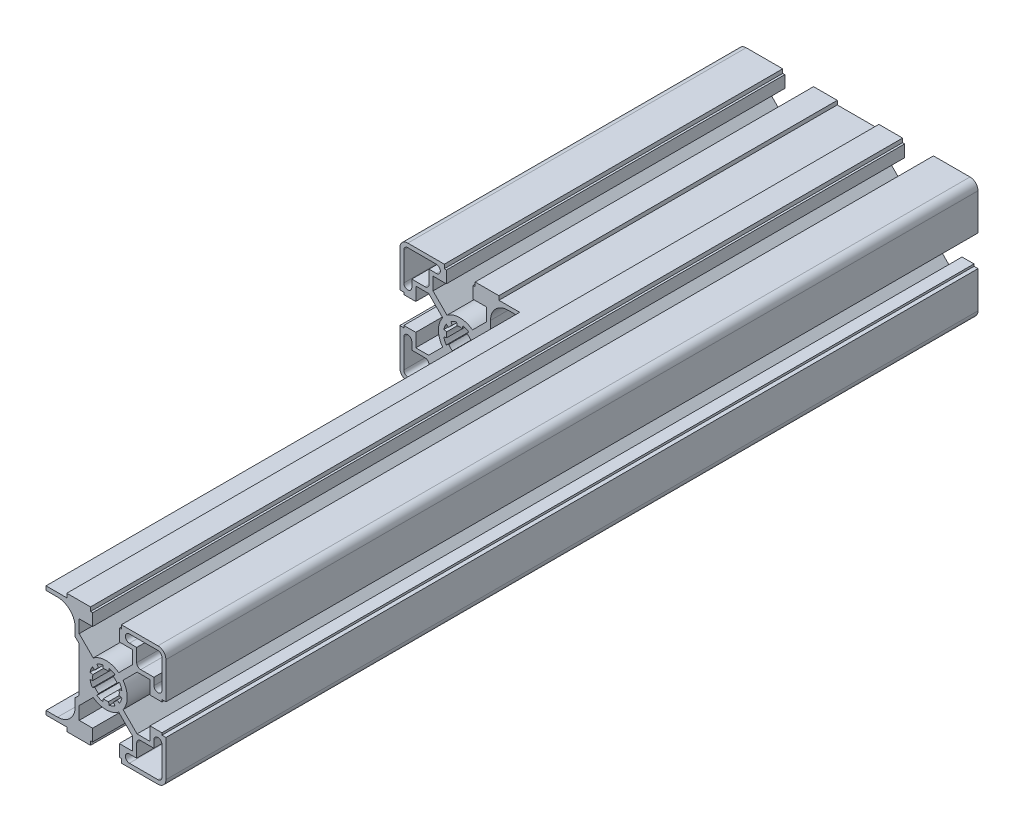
SolidWorks part; units mm, degrees
ref_plane "Front Plane" through (0, 0, 0) normal (0, 0, 1) x (1, 0, 0)
ref_plane "Top Plane" through (0, 0, 0) normal (0, 1, 0) x (1, 0, 0)
ref_plane "Right Plane" through (0, 0, 0) normal (1, 0, 0) x (0, 0, -1)
sketch "Sketch1" plane through (0, 0, 0) normal (0, 0, 1) x (1, 0, 0)
  line L0 (-27.5082, 0) -> (-17.5006, 0) construction
  line L1 (17.5006, 0) -> (27.5082, 0) construction
  line L2 (-42.0116, 22.5044) -> (-28.2956, 22.5044)
  line L3 (-28.2956, 22.5044) -> (-28.2956, 21.0058)
  line L4 (-28.2956, 21.0058) -> (-27.5082, 21.0058)
  line L5 (22.5044, -5.0038) -> (22.5044, 5.0038) construction
  line L6 (-27.5082, 21.0058) -> (-27.5082, 16.51)
  line L7 (-27.5082, 16.51) -> (-32.5501, 16.51)
  line L8 (-32.5501, 16.51) -> (-32.5501, 11.6801)
  line L9 (-32.5501, 11.6801) -> (-27.2854, 6.4154)
  line L11 (-34.1845, 10.0457) -> (-28.9198, 4.781)
  line L12 (-39.0144, 10.0457) -> (-34.1845, 10.0457)
  line L13 (-39.0144, 5.0038) -> (-39.0144, 10.0457)
  line L14 (-43.5102, 5.0038) -> (-39.0144, 5.0038)
  line L15 (-43.5102, 5.7912) -> (-43.5102, 5.0038)
  line L16 (-45.0088, 5.7912) -> (-43.5102, 5.7912)
  line L17 (-45.0088, 19.5072) -> (-45.0088, 5.7912)
  line L18 (-40.513, 11.5443) -> (-35.5473, 11.5443)
  line L19 (-40.513, 11.5443) -> (-40.513, 8.7884)
  line L20 (-34.0487, 18.0086) -> (-34.0487, 13.0429)
  line L21 (-43.5102, 19.5072) -> (-43.5102, 8.7884)
  line L23 (-34.0487, 18.0086) -> (-31.2928, 18.0086)
  line L24 (-42.0116, 21.0058) -> (-31.2928, 21.0058)
  line L25 (-21.3151, 5.9789) -> (-21.5282, 4.9077)
  line L26 (-23.6937, 5.9789) -> (-23.4806, 4.9077)
  line L27 (-17.4358, 3.3868) -> (-18.3439, 2.78)
  line L28 (-19.1176, 5.0686) -> (-19.7244, 4.1605)
  line L29 (-16.5255, -1.1893) -> (-17.5967, -0.9762)
  line L30 (-16.5255, 1.1893) -> (-17.5967, 0.9762)
  line L31 (-19.1176, -5.0686) -> (-19.7244, -4.1605)
  line L32 (-17.4358, -3.3868) -> (-18.3439, -2.78)
  line L33 (-23.6937, -5.9789) -> (-23.4806, -4.9077)
  line L34 (-21.3151, -5.9789) -> (-21.5282, -4.9077)
  line L35 (-27.573, -3.3868) -> (-26.6649, -2.78)
  line L36 (-25.8912, -5.0686) -> (-25.2844, -4.1605)
  line L37 (-28.4833, 1.1893) -> (-27.4121, 0.9762)
  line L38 (-28.4833, -1.1893) -> (-27.4121, -0.9762)
  line L39 (-25.8912, 5.0686) -> (-25.2844, 4.1605)
  line L40 (-27.573, 3.3868) -> (-26.6649, 2.78)
  line L41 (-7.8105, 22.5044) -> (-7.8105, 21.0058)
  line L42 (-7.8105, 21.0058) -> (7.8105, 21.0058)
  line L43 (-7.8105, 22.5044) -> (-16.7132, 22.5044)
  line L44 (-16.7132, 22.5044) -> (-16.7132, 21.0058)
  line L45 (-16.7132, 21.0058) -> (-17.5006, 21.0058)
  line L46 (-17.5006, 21.0058) -> (-17.5006, 16.51)
  line L47 (-17.5006, 16.51) -> (-12.4587, 16.51)
  line L48 (-12.4587, 16.51) -> (-12.4587, 11.6801)
  line L49 (-12.4587, 11.6801) -> (-17.7234, 6.4154)
  line L50 (-10.9601, 9.9099) -> (-12.4587, 8.4113)
  line L51 (7.8105, 21.0058) -> (7.8105, 22.5044)
  line L53 (-7.8105, -22.5044) -> (-16.7132, -22.5044)
  line L54 (7.8105, -22.5044) -> (16.7132, -22.5044)
  line L55 (7.8105, -21.0058) -> (7.8105, -22.5044)
  line L56 (-7.8105, -21.0058) -> (7.8105, -21.0058)
  line L57 (-7.8105, -22.5044) -> (-7.8105, -21.0058)
  line L58 (-40.513, -11.5443) -> (-35.5473, -11.5443)
  line L59 (4.3561, 19.5072) -> (-4.3561, 19.5072)
  line L60 (-10.9601, 12.9032) -> (-10.9601, 9.9099)
  line L61 (-12.4587, -8.4113) -> (-10.9601, -9.9099)
  line L62 (-12.4587, 8.4113) -> (-12.4587, -8.4113)
  line L63 (-10.9601, -12.9032) -> (-10.9601, -9.9099)
  line L64 (4.3561, -19.5072) -> (-4.3561, -19.5072)
  line L65 (10.9601, 12.9032) -> (10.9601, 9.9099)
  line L66 (10.9601, -12.9032) -> (10.9601, -9.9099)
  line L67 (12.4587, 8.4113) -> (12.4587, -8.4113)
  line L68 (10.9601, -9.9099) -> (12.4587, -8.4113)
  line L69 (10.9601, 9.9099) -> (12.4587, 8.4113)
  line L70 (-12.4587, -11.6801) -> (-17.7234, -6.4154)
  line L71 (-12.4587, -16.51) -> (-12.4587, -11.6801)
  line L72 (-17.5006, -16.51) -> (-12.4587, -16.51)
  line L73 (-17.5006, -21.0058) -> (-17.5006, -16.51)
  line L74 (-16.7132, -21.0058) -> (-17.5006, -21.0058)
  line L75 (-16.7132, -22.5044) -> (-16.7132, -21.0058)
  line L76 (-34.0487, -18.0086) -> (-31.2928, -18.0086)
  line L77 (-42.0116, -21.0058) -> (-31.2928, -21.0058)
  line L78 (-42.0116, -22.5044) -> (-28.2956, -22.5044)
  line L79 (-28.2956, -22.5044) -> (-28.2956, -21.0058)
  line L80 (-28.2956, -21.0058) -> (-27.5082, -21.0058)
  line L81 (-27.5082, -21.0058) -> (-27.5082, -16.51)
  line L82 (-27.5082, -16.51) -> (-32.5501, -16.51)
  line L83 (-32.5501, -16.51) -> (-32.5501, -11.6801)
  line L84 (-32.5501, -11.6801) -> (-27.2854, -6.4154)
  line L85 (-34.1845, -10.0457) -> (-28.9198, -4.781)
  line L86 (-43.5102, -19.5072) -> (-43.5102, -8.7884)
  line L87 (-34.0487, -18.0086) -> (-34.0487, -13.0429)
  line L88 (-40.513, -11.5443) -> (-40.513, -8.7884)
  line L89 (-45.0088, -19.5072) -> (-45.0088, -5.7912)
  line L90 (-45.0088, -5.7912) -> (-43.5102, -5.7912)
  line L91 (-43.5102, -5.7912) -> (-43.5102, -5.0038)
  line L92 (-43.5102, -5.0038) -> (-39.0144, -5.0038)
  line L93 (-39.0144, -5.0038) -> (-39.0144, -10.0457)
  line L94 (-39.0144, -10.0457) -> (-34.1845, -10.0457)
  line L96 (42.0116, 21.0058) -> (31.2928, 21.0058)
  line L97 (42.0116, 22.5044) -> (28.2956, 22.5044)
  line L98 (34.0487, 18.0086) -> (31.2928, 18.0086)
  line L99 (27.5082, 21.0058) -> (27.5082, 16.51)
  line L100 (28.2956, 21.0058) -> (27.5082, 21.0058)
  line L101 (28.2956, 22.5044) -> (28.2956, 21.0058)
  line L102 (17.5006, 21.0058) -> (17.5006, 16.51)
  line L103 (16.7132, 21.0058) -> (17.5006, 21.0058)
  line L104 (16.7132, 22.5044) -> (16.7132, 21.0058)
  line L105 (7.8105, 22.5044) -> (16.7132, 22.5044)
  line L106 (39.0144, -10.0457) -> (34.1845, -10.0457)
  line L107 (39.0144, -5.0038) -> (39.0144, -10.0457)
  line L108 (43.5102, -5.0038) -> (39.0144, -5.0038)
  line L109 (43.5102, -5.7912) -> (43.5102, -5.0038)
  line L110 (45.0088, -5.7912) -> (43.5102, -5.7912)
  line L111 (45.0088, -19.5072) -> (45.0088, -5.7912)
  line L112 (40.513, -11.5443) -> (35.5473, -11.5443)
  line L113 (40.513, -11.5443) -> (40.513, -8.7884)
  line L114 (34.0487, -18.0086) -> (34.0487, -13.0429)
  line L115 (43.5102, -19.5072) -> (43.5102, -8.7884)
  line L116 (34.1845, -10.0457) -> (28.9198, -4.781)
  line L117 (32.5501, -11.6801) -> (27.2854, -6.4154)
  line L118 (32.5501, -16.51) -> (32.5501, -11.6801)
  line L119 (27.5082, -16.51) -> (32.5501, -16.51)
  line L120 (27.5082, -21.0058) -> (27.5082, -16.51)
  line L121 (28.2956, -21.0058) -> (27.5082, -21.0058)
  line L122 (28.2956, -22.5044) -> (28.2956, -21.0058)
  line L123 (42.0116, -22.5044) -> (28.2956, -22.5044)
  line L124 (42.0116, -21.0058) -> (31.2928, -21.0058)
  line L125 (34.0487, -18.0086) -> (31.2928, -18.0086)
  line L126 (16.7132, -22.5044) -> (16.7132, -21.0058)
  line L127 (16.7132, -21.0058) -> (17.5006, -21.0058)
  line L128 (17.5006, -21.0058) -> (17.5006, -16.51)
  line L129 (17.5006, -16.51) -> (12.4587, -16.51)
  line L130 (12.4587, -16.51) -> (12.4587, -11.6801)
  line L131 (12.4587, -11.6801) -> (17.7234, -6.4154)
  line L132 (12.4587, 11.6801) -> (17.7234, 6.4154)
  line L133 (12.4587, 16.51) -> (12.4587, 11.6801)
  line L134 (27.573, 3.3868) -> (26.6649, 2.78)
  line L135 (25.8912, 5.0686) -> (25.2844, 4.1605)
  line L136 (28.4833, -1.1893) -> (27.4121, -0.9762)
  line L137 (28.4833, 1.1893) -> (27.4121, 0.9762)
  line L138 (25.8912, -5.0686) -> (25.2844, -4.1605)
  line L139 (27.573, -3.3868) -> (26.6649, -2.78)
  line L140 (21.3151, -5.9789) -> (21.5282, -4.9077)
  line L141 (23.6937, -5.9789) -> (23.4806, -4.9077)
  line L142 (17.4358, -3.3868) -> (18.3439, -2.78)
  line L143 (19.1176, -5.0686) -> (19.7244, -4.1605)
  line L144 (16.5255, 1.1893) -> (17.5967, 0.9762)
  line L145 (16.5255, -1.1893) -> (17.5967, -0.9762)
  line L146 (19.1176, 5.0686) -> (19.7244, 4.1605)
  line L147 (17.4358, 3.3868) -> (18.3439, 2.78)
  line L148 (23.6937, 5.9789) -> (23.4806, 4.9077)
  line L149 (21.3151, 5.9789) -> (21.5282, 4.9077)
  line L150 (43.5102, 19.5072) -> (43.5102, 8.7884)
  line L151 (34.0487, 18.0086) -> (34.0487, 13.0429)
  line L152 (40.513, 11.5443) -> (40.513, 8.7884)
  line L153 (40.513, 11.5443) -> (35.5473, 11.5443)
  line L154 (45.0088, 19.5072) -> (45.0088, 5.7912)
  line L155 (45.0088, 5.7912) -> (43.5102, 5.7912)
  line L156 (43.5102, 5.7912) -> (43.5102, 5.0038)
  line L157 (43.5102, 5.0038) -> (39.0144, 5.0038)
  line L158 (39.0144, 5.0038) -> (39.0144, 10.0457)
  line L159 (39.0144, 10.0457) -> (34.1845, 10.0457)
  line L160 (34.1845, 10.0457) -> (28.9198, 4.781)
  line L161 (32.5501, 11.6801) -> (27.2854, 6.4154)
  line L162 (32.5501, 16.51) -> (32.5501, 11.6801)
  line L163 (12.4587, 16.51) -> (17.5006, 16.51)
  line L164 (27.5082, 16.51) -> (32.5501, 16.51)
  arc A0 (-45.0088, 19.5072) -> (-42.0116, 22.5044) centre (-42.0116, 19.5072) cw
  arc A1 (-43.5102, 8.7884) -> (-40.513, 8.7884) centre (-42.0116, 8.7884) ccw
  arc A2 (-43.5102, 19.5072) -> (-42.0116, 21.0058) centre (-42.0116, 19.5072) cw
  arc A3 (-31.2928, 21.0058) -> (-31.2928, 18.0086) centre (-31.2928, 19.5072) cw
  arc A4 (-34.0487, 13.0429) -> (-35.5473, 11.5443) centre (-35.5473, 13.0429) cw
  arc A6 (-21.5282, 4.9077) -> (-23.4806, 4.9077) centre (-22.5044, 0) ccw
  arc A7 (-27.573, 3.3868) -> (-28.4833, 1.1893) centre (-22.5044, 0) ccw
  arc A8 (-18.3439, 2.78) -> (-19.7244, 4.1605) centre (-22.5044, 0) ccw
  arc A9 (-17.5967, -0.9762) -> (-17.5967, 0.9762) centre (-22.5044, 0) ccw
  arc A10 (-19.7244, -4.1605) -> (-18.3439, -2.78) centre (-22.5044, 0) ccw
  arc A11 (-23.4806, -4.9077) -> (-21.5282, -4.9077) centre (-22.5044, 0) ccw
  arc A12 (-26.6649, -2.78) -> (-25.2844, -4.1605) centre (-22.5044, 0) ccw
  arc A13 (-27.4121, 0.9762) -> (-27.4121, -0.9762) centre (-22.5044, 0) ccw
  arc A14 (-25.2844, 4.1605) -> (-26.6649, 2.78) centre (-22.5044, 0) ccw
  arc A15 (-28.4833, -1.1893) -> (-27.573, -3.3868) centre (-22.5044, 0) ccw
  arc A16 (-25.8912, -5.0686) -> (-23.6937, -5.9789) centre (-22.5044, 0) ccw
  arc A17 (-21.3151, -5.9789) -> (-19.1176, -5.0686) centre (-22.5044, 0) ccw
  arc A18 (-17.4358, -3.3868) -> (-16.5255, -1.1893) centre (-22.5044, 0) ccw
  arc A19 (-16.5255, 1.1893) -> (-17.4358, 3.3868) centre (-22.5044, 0) ccw
  arc A20 (-19.1176, 5.0686) -> (-21.3151, 5.9789) centre (-22.5044, 0) ccw
  arc A21 (-23.6937, 5.9789) -> (-25.8912, 5.0686) centre (-22.5044, 0) ccw
  arc A22 (-34.0487, -13.0429) -> (-35.5473, -11.5443) centre (-35.5473, -13.0429) ccw
  arc A23 (-4.3561, 19.5072) -> (-10.9601, 12.9032) centre (-4.3561, 12.9032) ccw
  arc A24 (-4.3561, -19.5072) -> (-10.9601, -12.9032) centre (-4.3561, -12.9032) cw
  arc A25 (4.3561, 19.5072) -> (10.9601, 12.9032) centre (4.3561, 12.9032) cw
  arc A26 (4.3561, -19.5072) -> (10.9601, -12.9032) centre (4.3561, -12.9032) ccw
  arc A27 (-31.2928, -21.0058) -> (-31.2928, -18.0086) centre (-31.2928, -19.5072) ccw
  arc A28 (-43.5102, -19.5072) -> (-42.0116, -21.0058) centre (-42.0116, -19.5072) ccw
  arc A29 (-45.0088, -19.5072) -> (-42.0116, -22.5044) centre (-42.0116, -19.5072) ccw
  arc A30 (-43.5102, -8.7884) -> (-40.513, -8.7884) centre (-42.0116, -8.7884) cw
  arc A31 (-17.7234, 6.4154) -> (-27.2854, 6.4154) centre (-22.5044, 0) ccw
  arc A32 (-27.2854, -6.4154) -> (-17.7234, -6.4154) centre (-22.5044, 0) ccw
  arc A33 (-28.9198, 4.781) -> (-28.9198, -4.781) centre (-22.5044, 0) ccw
  arc A34 (45.0088, 19.5072) -> (42.0116, 22.5044) centre (42.0116, 19.5072) ccw
  arc A35 (43.5102, 19.5072) -> (42.0116, 21.0058) centre (42.0116, 19.5072) ccw
  arc A36 (31.2928, 21.0058) -> (31.2928, 18.0086) centre (31.2928, 19.5072) ccw
  arc A37 (28.9198, 4.781) -> (28.9198, -4.781) centre (22.5044, 0) cw
  arc A38 (27.2854, -6.4154) -> (17.7234, -6.4154) centre (22.5044, 0) cw
  arc A39 (17.7234, 6.4154) -> (27.2854, 6.4154) centre (22.5044, 0) cw
  arc A40 (43.5102, -8.7884) -> (40.513, -8.7884) centre (42.0116, -8.7884) ccw
  arc A41 (34.0487, -13.0429) -> (35.5473, -11.5443) centre (35.5473, -13.0429) cw
  arc A42 (45.0088, -19.5072) -> (42.0116, -22.5044) centre (42.0116, -19.5072) cw
  arc A43 (43.5102, -19.5072) -> (42.0116, -21.0058) centre (42.0116, -19.5072) cw
  arc A44 (31.2928, -21.0058) -> (31.2928, -18.0086) centre (31.2928, -19.5072) cw
  arc A45 (23.6937, 5.9789) -> (25.8912, 5.0686) centre (22.5044, 0) cw
  arc A46 (19.1176, 5.0686) -> (21.3151, 5.9789) centre (22.5044, 0) cw
  arc A47 (16.5255, 1.1893) -> (17.4358, 3.3868) centre (22.5044, 0) cw
  arc A48 (17.4358, -3.3868) -> (16.5255, -1.1893) centre (22.5044, 0) cw
  arc A49 (21.3151, -5.9789) -> (19.1176, -5.0686) centre (22.5044, 0) cw
  arc A50 (25.8912, -5.0686) -> (23.6937, -5.9789) centre (22.5044, 0) cw
  arc A51 (28.4833, -1.1893) -> (27.573, -3.3868) centre (22.5044, 0) cw
  arc A52 (25.2844, 4.1605) -> (26.6649, 2.78) centre (22.5044, 0) cw
  arc A53 (27.4121, 0.9762) -> (27.4121, -0.9762) centre (22.5044, 0) cw
  arc A54 (26.6649, -2.78) -> (25.2844, -4.1605) centre (22.5044, 0) cw
  arc A55 (23.4806, -4.9077) -> (21.5282, -4.9077) centre (22.5044, 0) cw
  arc A56 (19.7244, -4.1605) -> (18.3439, -2.78) centre (22.5044, 0) cw
  arc A57 (17.5967, -0.9762) -> (17.5967, 0.9762) centre (22.5044, 0) cw
  arc A58 (18.3439, 2.78) -> (19.7244, 4.1605) centre (22.5044, 0) cw
  arc A59 (27.573, 3.3868) -> (28.4833, 1.1893) centre (22.5044, 0) cw
  arc A60 (21.5282, 4.9077) -> (23.4806, 4.9077) centre (22.5044, 0) cw
  arc A62 (34.0487, 13.0429) -> (35.5473, 11.5443) centre (35.5473, 13.0429) ccw
  arc A63 (43.5102, 8.7884) -> (40.513, 8.7884) centre (42.0116, 8.7884) cw
extrude "Boss-Extrude1" add sketch "Sketch1" along normal mid plane 304.8
sketch "Sketch2" plane through (0, 0, 152.4) normal (0, 0, 1) x (1, 0, 0)
  line L0 (7.8105, 21.0058) -> (-7.8105, 21.0058) construction
  line L1 (-45.0088, 22.5044) -> (0, 22.5044)
  line L2 (-45.0088, 22.5044) -> (-45.0088, -22.5044)
  line L3 (-45.0088, -22.5044) -> (0, -22.5044)
  line L4 (0, 22.5044) -> (0, -22.5044)
  line L5 (-28.2956, 22.5044) -> (-42.0116, 22.5044) construction
  line L6 (-42.0116, -22.5044) -> (-28.2956, -22.5044) construction
  line L7 (-45.0088, 19.5072) -> (-45.0088, 5.7912) construction
  point P6 (0, 21.0058)
extrude "Cut-Extrude1" cut sketch "Sketch2" against normal blind 177.8
